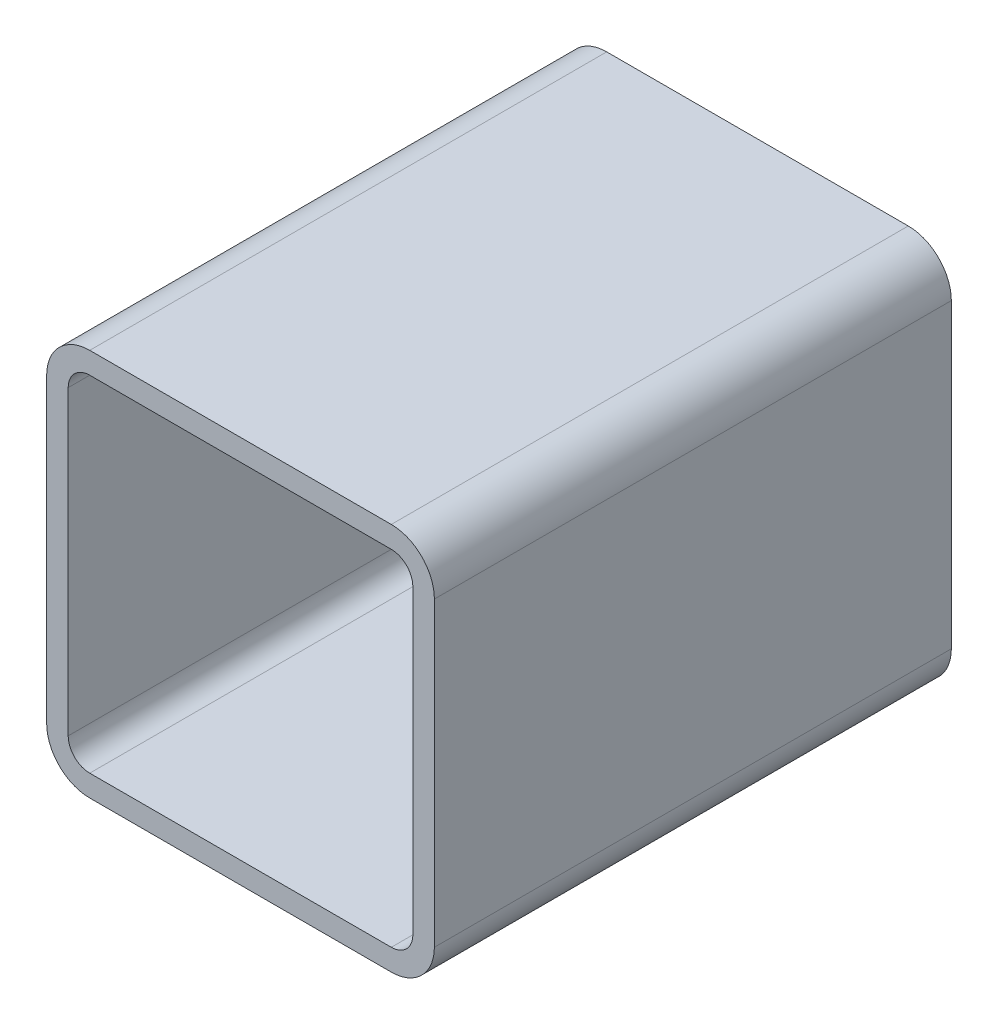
SolidWorks part; units mm, degrees
ref_plane "Front Plane" through (0, 0, 0) normal (0, 0, 1) x (1, 0, 0)
ref_plane "Top Plane" through (0, 0, 0) normal (0, 1, 0) x (1, 0, 0)
ref_plane "Right Plane" through (0, 0, 0) normal (1, 0, 0) x (0, 0, -1)
sketch "Sketch1" plane through (0, 0, 0) normal (0, 0, 1) x (1, 0, 0)
sketch_block_instance "HSS9x9x0.500-1"
sketch_block "HSS9x9x0.500"
extrude "Boss-Extrude1" add sketch "Sketch1" along normal blind 304.8
